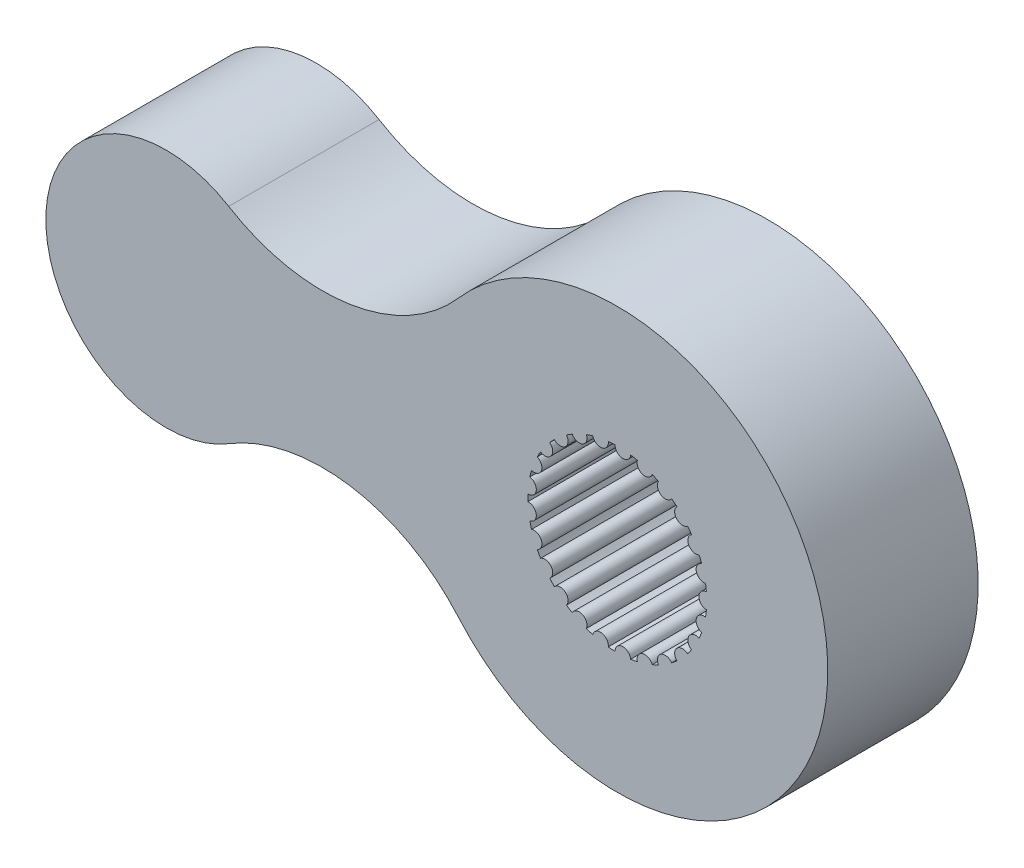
SolidWorks part; units mm, degrees
ref_plane "Plan de face" through (0, 0, 0) normal (0, 0, 1) x (1, 0, 0)
ref_plane "Plan de dessus" through (0, 0, 0) normal (0, 1, 0) x (1, 0, 0)
ref_plane "Plan de droite" through (0, 0, 0) normal (1, 0, 0) x (0, 0, -1)
sketch "Esquisse1" plane through (0, 0, 0) normal (0, 0, 1) x (1, 0, 0)
  line L0 (0, 0) -> (-30, 0) construction
  circle A0 centre (0, 0) radius 2.975
  arc A1 (-5.2769, -4.5994) -> (-5.2769, 4.5994) centre (0, 0) ccw
  arc A2 (-12.92, 3.4167) -> (-12.92, -3.4167) centre (-15, 0) ccw
  arc A3 (-12.92, 3.4167) -> (-5.2769, 4.5994) centre (-9.8, 8.5417) ccw
  arc A4 (-5.2769, -4.5994) -> (-12.92, -3.4167) centre (-9.8, -8.5417) ccw
  dimension "D1" = 5.95
  dimension "D2" = 14
  dimension "D3" = 15
  dimension "D4" = 8
  dimension "D5" = 6
  dimension "D6" = 6
extrude "Boss.-Extru.1" add sketch "Esquisse1" along normal blind 5
sketch "Esquisse2" plane through (0, 0, 5) normal (0, 0, 1) x (1, 0, 0)
  circle A0 centre (2.975, 0) radius 0.26
  circle A1 centre (0, 0) radius 2.975 construction
  circle A2 centre (2.8815, -0.7399) radius 0.26
  circle A3 centre (2.607, -1.4332) radius 0.26
  circle A4 centre (2.1687, -2.0365) radius 0.26
  circle A5 centre (1.5941, -2.5119) radius 0.26
  circle A6 centre (0.9193, -2.8294) radius 0.26
  circle A7 centre (0.1868, -2.9691) radius 0.26
  circle A8 centre (-0.5575, -2.9223) radius 0.26
  circle A9 centre (-1.2667, -2.6919) radius 0.26
  circle A10 centre (-1.8963, -2.2923) radius 0.26
  circle A11 centre (-2.4068, -1.7487) radius 0.26
  circle A12 centre (-2.7661, -1.0952) radius 0.26
  circle A13 centre (-2.9515, -0.3729) radius 0.26
  circle A14 centre (-2.9515, 0.3729) radius 0.26
  circle A15 centre (-2.7661, 1.0952) radius 0.26
  circle A16 centre (-2.4068, 1.7487) radius 0.26
  circle A17 centre (-1.8963, 2.2923) radius 0.26
  circle A18 centre (-1.2667, 2.6919) radius 0.26
  circle A19 centre (-0.5575, 2.9223) radius 0.26
  circle A20 centre (0.1868, 2.9691) radius 0.26
  circle A21 centre (0.9193, 2.8294) radius 0.26
  circle A22 centre (1.5941, 2.5119) radius 0.26
  circle A23 centre (2.1687, 2.0365) radius 0.26
  circle A24 centre (2.607, 1.4332) radius 0.26
  circle A25 centre (2.8815, 0.7399) radius 0.26
  point P55 (0, 0)
  dimension "D1" = 0.52
  dimension "D2" = 25
extrude "Boss.-Extru.2" add sketch "Esquisse2" against normal blind 5
